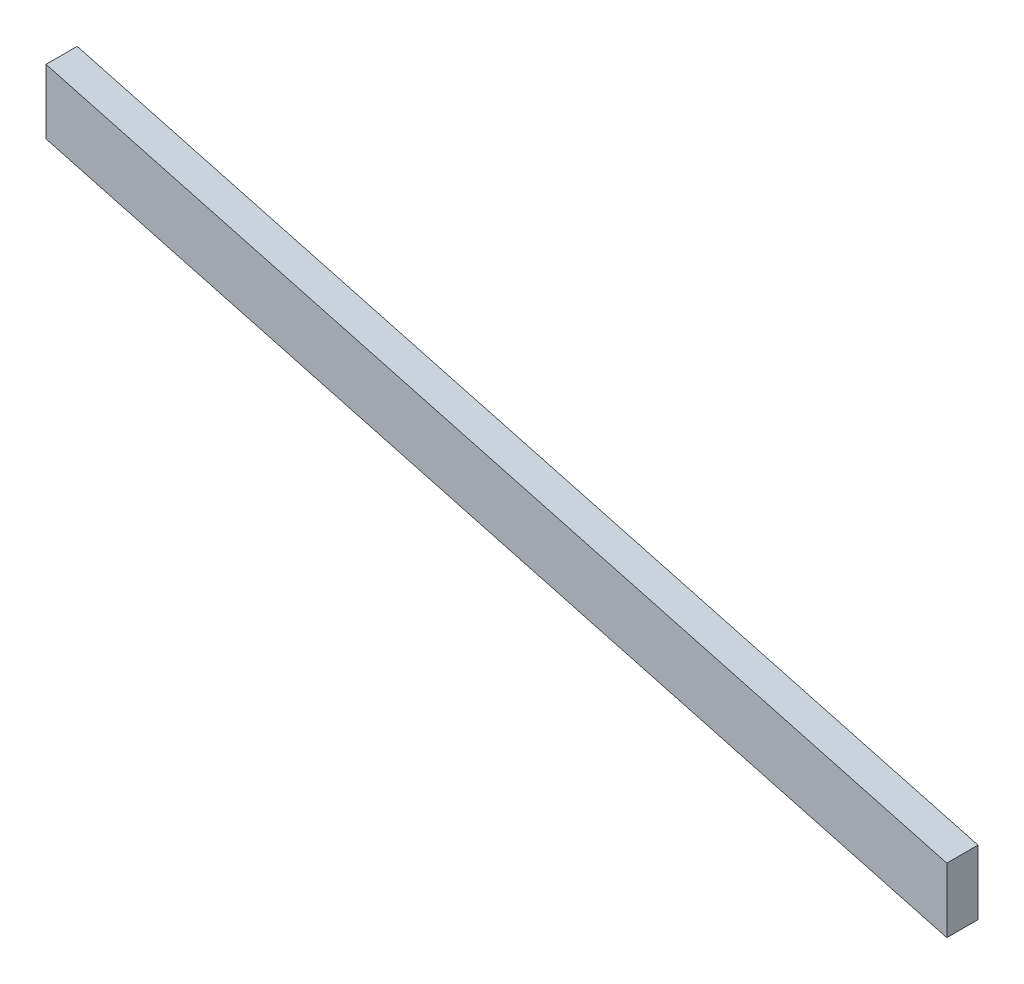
SolidWorks part; units mm, degrees
ref_plane "Face" through (0, 0, 0) normal (0, 0, 1) x (1, 0, 0)
ref_plane "Dessus" through (0, 0, 0) normal (0, 1, 0) x (1, 0, 0)
ref_plane "Droite" through (0, 0, 0) normal (1, 0, 0) x (0, 0, -1)
sketch "Esquisse1" plane through (0, 0, 0) normal (0, 0, 1) x (1, 0, 0)
  line L0 (3655.6731, 3013.8909) -> (3655.6731, 3096.713)
  line L1 (3655.6731, 3096.713) -> (2499.881, 3406.4066)
  line L2 (2499.881, 3406.4066) -> (2499.881, 3323.5845)
  line L3 (2499.881, 3323.5845) -> (3655.6731, 3013.8909)
extrude "Base-Extrusion" add sketch "Esquisse1" along normal blind 40
